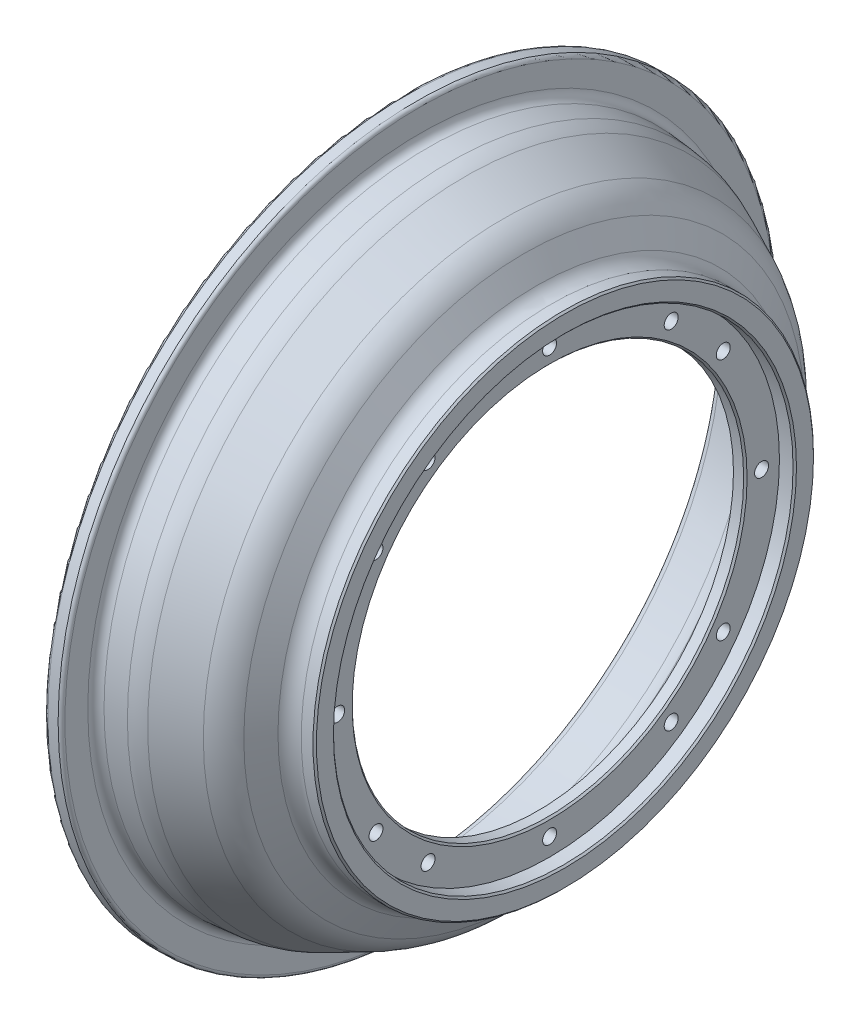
SolidWorks part; units mm, degrees
ref_plane "Front Plane" through (0, 0, 0) normal (0, 0, 1) x (1, 0, 0)
ref_plane "Top Plane" through (0, 0, 0) normal (0, 1, 0) x (1, 0, 0)
ref_plane "Right Plane" through (0, 0, 0) normal (1, 0, 0) x (0, 0, -1)
sketch "Sketch1" plane through (0, 0, 0) normal (0, 0, 1) x (1, 0, 0)
  line L0 (0, 0) -> (-293.2198, 0) construction
  line L1 (0, 135) -> (-9, 135)
  line L2 (-9, 135) -> (-9, 115)
  line L3 (0, 135) -> (0, 147)
  line L4 (-9, 115) -> (-16, 115)
  line L5 (-16, 115) -> (-16, 135)
  line L6 (-16, 135) -> (-33.9952, 166.1686)
  line L7 (-33.9952, 166.1686) -> (-65.2, 180.7197)
  line L8 (-65.2, 180.7197) -> (-95.2, 183.3443)
  line L9 (-95.2, 183.3443) -> (-95.2, 210.5)
  line L10 (-95.2, 210.5) -> (-85.2, 210.5)
  line L11 (-85.2, 210.5) -> (-85.2, 190.5)
  line L12 (-85.2, 190.5) -> (-63.0975, 188.5663)
  line L13 (-63.0975, 188.5663) -> (-28.3282, 172.3531)
  line L14 (-28.3282, 172.3531) -> (-13.6906, 147)
  line L15 (-13.6906, 147) -> (0, 147)
  dimension "D1" = 270
  dimension "D2" = 230
  dimension "D3" = 9
  dimension "D4" = 7
  dimension "D5" = 20
  dimension "D6" = 76.2
  dimension "D7" = 10
  dimension "D8" = 8
  dimension "D9" = 8
  dimension "D10" = 8
  dimension "D11" = 12
  dimension "D12" = 381
  dimension "D13" = 20
  dimension "D14" = 150
  dimension "D15" = 145
  dimension "D16" = 95
  dimension "D17" = 30
revolve "Revolve1" add sketch "Sketch1" angle 360 about L0
sketch "Sketch2" plane through (-16, 0, 0) normal (-1, 0, 0) x (0, 0, 1)
  line L0 (0, 124.5) -> (0, 0) construction
  line L1 (0, 0) -> (71.4103, 101.9844) construction
  line L2 (0, 0) -> (101.9844, 71.4103) construction
  line L3 (0, 0) -> (88.0348, 88.0348) construction
  line L4 (71.4103, 101.9844) -> (101.9844, 71.4103) construction
  circle A0 centre (0, 124.5) radius 4.1
  circle A1 centre (71.4103, 101.9844) radius 4.1
  circle A2 centre (101.9844, 71.4103) radius 4.1
  circle A3 centre (0, 0) radius 124.5 construction
  point P10 (86.6973, 86.6973)
  dimension "D1" = 249
  dimension "D2" = 8.2
  dimension "D3" = 20
  dimension "D4" = 45
extrude "Cut-Extrude1" cut sketch "Sketch2" against normal blind 10
pattern_circular "CirPattern1" count 4 over 360 about axis through (0, 0, 0) along (1, 0, 0) of "Cut-Extrude1"
fillet "Fillet1" radius 20 2 edges at (-65.2, 0, -180.7197) (-33.9952, 0, -166.1686)
fillet "Fillet2" radius 28 2 edges at (-63.0975, 0, -188.5663) (-28.3282, 0, -172.3531)
fillet "Fillet3" radius 10 1 edges at (-13.6906, 0, -147)
chamfer "Chamfer1" distance 1 angle 45 3 edges at (-9, 0, -115) (0, 0, -135) (0, 0, -147)
fillet "Fillet4" radius 6 1 edges at (-16, 0, -135)
fillet "Fillet5" radius 5 2 edges at (-95.2, 0, -183.3443) (-85.2, 0, -190.5)
fillet "Fillet6" radius 2 2 edges at (-85.2, 0, -210.5) (-95.2, 0, -210.5)
sketch "Sketch3" plane through (0, 0, 0) normal (0, 1, 0) x (1, 0, 0)
  line L0 (-62.0039, 179.2293) -> (-39.7104, 168.8337)
  line L1 (-39.7104, -168.8337) -> (-62.0039, -179.2293)
  line L2 (-50.8571, 174.0315) -> (-58.5172, 157.6043) construction
  line L3 (-62.0039, 179.2293) -> (-39.7104, 168.8337)
ref_plane "Plane1" through (-58.5172, 0, -157.6043) normal (-0.4226, 0, 0.9063) x (0.9063, 0, 0.4226)
sketch "Sketch4" plane through (-58.5172, 0, -157.6043) normal (-0.4226, 0, 0.9063) x (0.9063, 0, 0.4226)
  circle A0 centre (0, 0) radius 6
  dimension "D1" = 12
extrude "Cut-Extrude2" cut sketch "Sketch4" against normal blind 36
